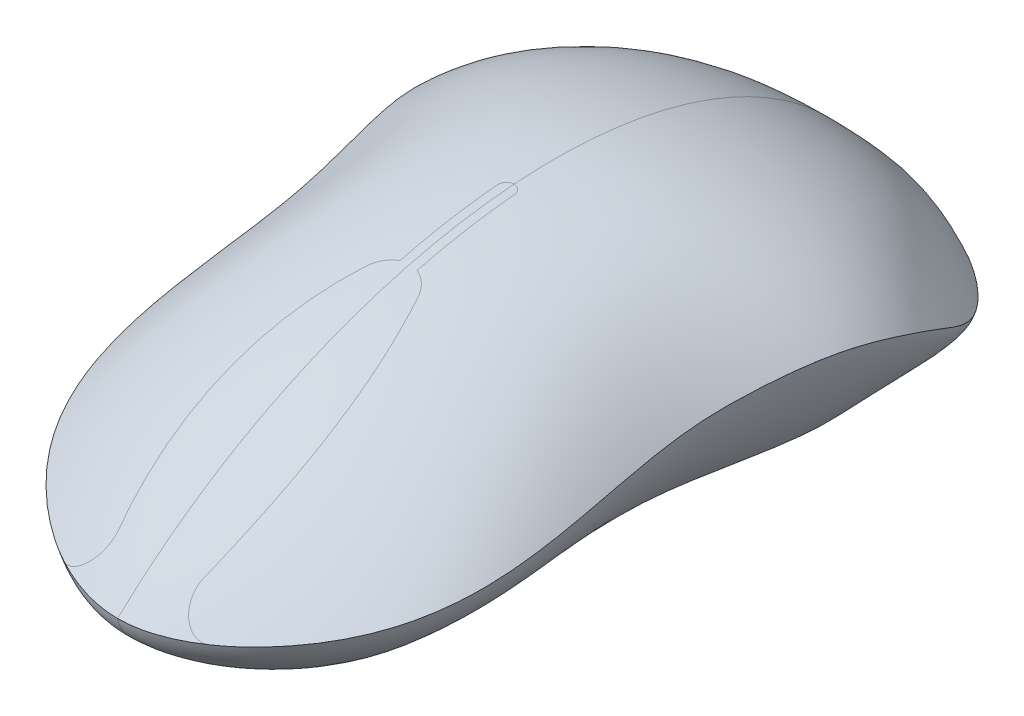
SolidWorks part; units mm, degrees
other "Bottom"
other "Top_Cover"
other "Wheel_Mount"
ref_plane "Front Plane" through (0, 0, 0) normal (0, 0, 1) x (1, 0, 0)
ref_plane "Top Plane" through (0, 0, 0) normal (0, 1, 0) x (1, 0, 0)
ref_plane "Right Plane" through (0, 0, 0) normal (1, 0, 0) x (0, 0, -1)
sketch "Size Reference" plane through (0, 0, 0) normal (0, 1, 0) x (1, 0, 0)
  line L1 (0, 0) -> (27, 0)
  line L2 (0, 0) -> (0, 123) construction
  line L3 (0, 123) -> (27, 123)
  line L4 (27, 0) -> (27, 123)
  dimension "D1" = 123
  dimension "D2" = 54
sketch "Bottom Edge" plane through (0, 0, 0) normal (0, 1, 0) x (1, 0, 0)
  line L0 (0, 123) -> (27, 123) construction
  line L1 (0, 0) -> (27, 0) construction
  line L2 (27, 0) -> (27, 123) construction
  line L4 (27, 93.3111) -> (27, 116.452) construction
  spline S0 degree 3 poles (0, 123) (12.2691, 123) (33.9646, 101.318) (16.4132, 60.3172) (32.5476, 16.6529) (8.4103, 0) (0, 0) knots 0 0 0 0 0.225854 0.474653 0.850222 1 1 1 1
sketch "PL Top Profile" plane through (0, 0, 0) normal (0, 1, 0) x (1, 0, 0)
  line L1 (-4.564, -5.3) -> (14.9352, -5.3) construction
  line L2 (12.7264, 128.6) -> (-2.9487, 128.6) construction
  spline S0 degree 3 poles (0, 128.6) (15.8519, 128.6) (50.8482, 104.1975) (28.4973, 67.1821) (42.1863, 15.7657) (10.559, -5.3) (0, -5.3) knots 0 0 0 0 0.168813 0.526967 0.825077 1 1 1 1
  dimension "D1" = 5.6
  dimension "D2" = 5.3
sketch "PL Side Profile" plane through (0, 0, 0) normal (1, 0, 0) x (0, 0, -1)
  line L0 (3.2374, 7.8706) -> (0.7101, 7.8706) construction
  spline S0 degree 3 poles (-5.3, 5.6219) (4.2177, 7.7505) (29.2394, 13.3466) (60.5196, 20.2129) (86.0321, 22.1333) (106.0141, 15.5511) (111.8339, 7.8706) (128.6, 7.8706) knots 0 0 0 0 0.22036 0.579318 0.678023 0.775619 1 1 1 1
curve "PL Curve"
sketch "Profile Sketch" plane through (0, 0, 0) normal (1, 0, 0) x (0, 0, -1)
  line L0 (0, 0) -> (28.271, -7.5752) construction
  line L1 (18.7981, 0) -> (-18.7981, 0) construction
  line L2 (123, 0) -> (0, 0) construction
  arc A0 (0, 0) -> (-5.3, 5.6219) centre (1.9034, 7.1036) cw
  arc A1 (123, 0) -> (128.6, 7.8706) centre (118.6653, 9.0117) ccw
  dimension "D2" = 10
  dimension "D1" = 15
ref_plane "Mid Plane" through (0, 0, -65.6195) normal (0, 0, 1) x (1, 0, 0)
sketch "Intermediate Profile" plane through (0, 0, -65.6195) normal (0, 0, 1) x (1, 0, 0)
  line L0 (23.1431, 0) -> (35.8003, 20.139) construction
  arc A0 (23.1431, 0) -> (35.8003, 20.139) centre (-17.9023, 39.8437) ccw
  dimension "D1" = 1.25
surface "Surface-Loft1"
sketch "Sketch1" plane through (0, 0, 0) normal (1, 0, 0) x (0, 0, -1)
  line L0 (50.804, -31.7684) -> (21.9756, 24.8105) construction
  line L1 (18.7981, 0) -> (-18.7981, 0) construction
  ellipse E0 centre (50.804, -31.7684) end of major axis (128.6, 7.8706) minor radius 63.5 (-5.3, 5.6219) -> (128.6, 7.8706) cw
  dimension "D1" = 117
  dimension "D2" = 63.5
surface "Surface-Extrude1" sketch "Sketch1" parameters "D1"=12.7
surface "Surface-Fill1"
mirror "Mirror1" about plane through (0, 0, 0) normal (1, 0, 0)
surface "Surface-Plane1"
surface "Surface-Knit1"
sketch "Sketch3" plane through (0, 0, 0) normal (0, 1, 0) x (1, 0, 0)
  line L0 (12.7869, -2) -> (1.513, -7.5548) construction
  line L1 (0, 0) -> (0, 52.4557) construction
  line L2 (12.7869, -2) -> (25.1296, 3.816) construction
  line L4 (1.5, 46.0363) -> (1.5, 63.2)
  line L6 (-1.5, 46.0363) -> (-1.5, 63.2)
  arc A0 (7.4808, 2.36) -> (4.6348, 43.1423) centre (-56.5448, 18.3824) ccw
  arc A1 (12.7869, -2) -> (7.4808, 2.36) centre (11.1671, 1.4375) cw
  arc A2 (4.6348, 43.1423) -> (1.5, 46.0363) centre (0, 41.2666) ccw
  arc A3 (-12.7869, -2) -> (-7.4808, 2.36) centre (-11.1671, 1.4375) ccw
  arc A4 (-7.4808, 2.36) -> (-4.6348, 43.1423) centre (56.5448, 18.3824) cw
  arc A5 (1.5, 63.2) -> (-1.5, 63.2) centre (0, 63.2) ccw
  arc A6 (-1.5, 46.0363) -> (-4.6348, 43.1423) centre (0, 41.2666) ccw
  spline S1 degree 3 number of poles 104 (0, 128.6) -> (0, -5.3) construction
  spline S2 degree 3 number of poles 104 (0, 128.6) -> (0, -5.3) construction
  dimension "D1" = 3.8
  dimension "D2" = 66
  dimension "D5" = 5
  dimension "D3" = 70
  dimension "D4" = 179
  dimension "D6" = 3
  dimension "D7" = 2.36
  dimension "D8" = 2
surface "Wheel Mount Split Surface" sketch "Sketch3"
sketch "Sketch4" plane through (0, 0, 0) normal (1, 0, 0) x (0, 0, -1)
  spline S0 degree 3 poles (-1975.015, -340.594) (-259.1542, -56.3727) (-154.4036, -26.965) (60.5196, 20.2129) (86.0321, 22.1333) (148.332, 1.6112) (71.5046, -54.866) (2013.1106, 676.3958) knots -3.980612 -3.980612 -3.980612 -3.980612 0.22036 0.579318 0.678023 0.775619 1.890919 1.890919 1.890919 1.890919 only from (-5.3, 5.6219) to (128.6, 7.8706) construction
  spline S1 degree 3 poles (-20.5035, 2.224) (-5.8238, 5.5002) (23.8395, 12.1612) (60.5196, 20.2129) (86.0321, 22.1333) (108.8227, 14.6259) (113.6519, 4.9606) (144.8194, 9.1071) knots -0.117049 -0.117049 -0.117049 -0.117049 0.22036 0.579318 0.678023 0.775619 1.059129 1.059129 1.059129 1.059129
surface "Surface-Extrude2" sketch "Sketch4" parameters "D1"=80
shell "Shell1" thickness 1.25
split "Split1" trimming surface bodies 141 bodies to split 139 resulting bodies 142 143
split "Split2" trimming surface bodies 140 bodies to split 143 resulting bodies 144 145
other "Save Bodies1"
